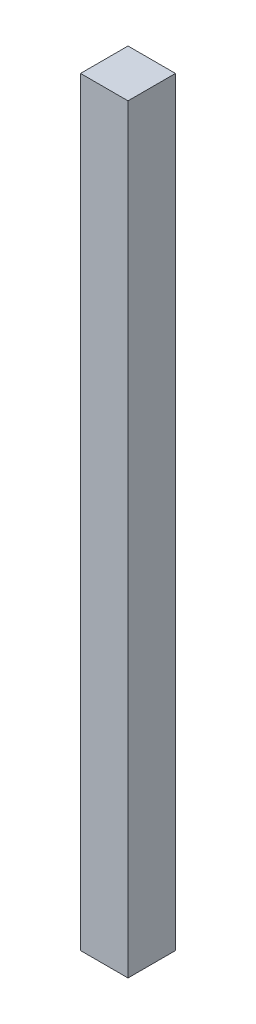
SolidWorks part; units mm, degrees
ref_plane "Front Plane" through (0, 0, 0) normal (0, 0, 1) x (1, 0, 0)
ref_plane "Top Plane" through (0, 0, 0) normal (0, 1, 0) x (1, 0, 0)
ref_plane "Right Plane" through (0, 0, 0) normal (1, 0, 0) x (0, 0, -1)
sketch "Sketch1" plane through (0, 0, 0) normal (0, 1, 0) x (1, 0, 0)
  line L1 (-25.4, 25.4) -> (25.4, 25.4)
  line L2 (-25.4, 25.4) -> (-25.4, -25.4)
  line L3 (-25.4, -25.4) -> (25.4, -25.4)
  line L4 (25.4, 25.4) -> (25.4, -25.4)
  line L5 (-25.4, 25.4) -> (25.4, -25.4) construction
  line L6 (-25.4, -25.4) -> (25.4, 25.4) construction
  point P0 (0, 0)
  dimension "D1" = 50.8
  dimension "D2" = 50.8
extrude "Boss-Extrude1" add sketch "Sketch1" along normal blind 812.8
